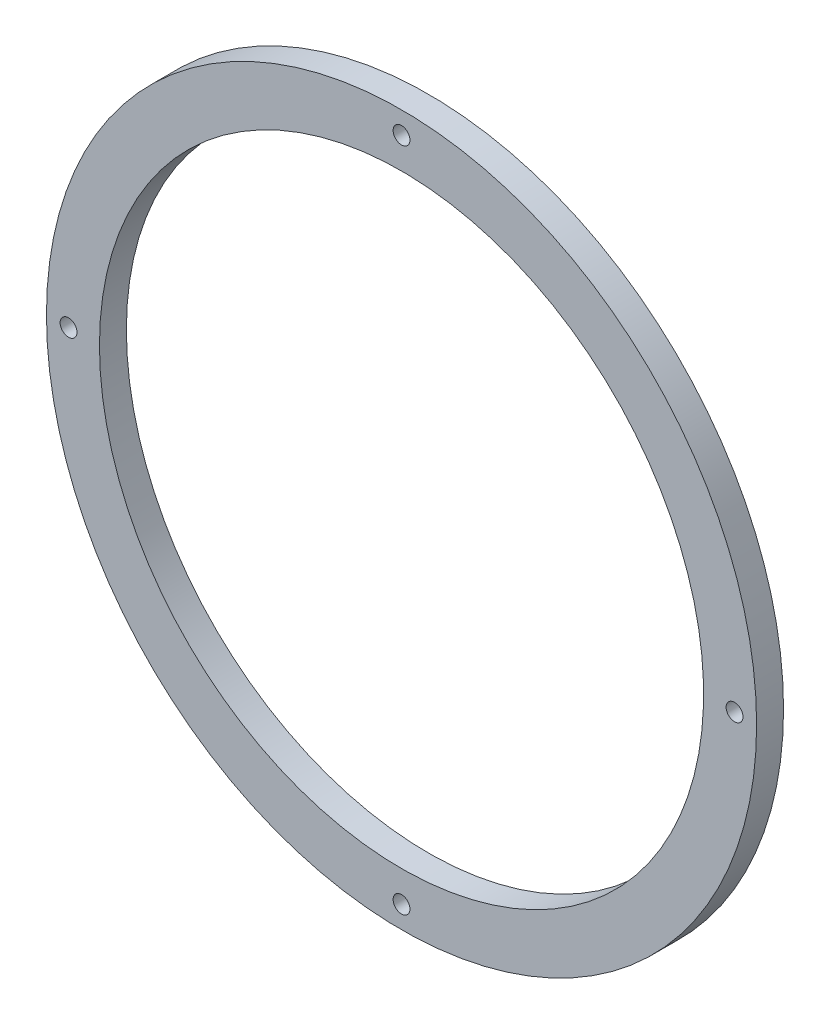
SolidWorks part; units mm, degrees
ref_plane "Front Plane" through (0, 0, 0) normal (0, 0, 1) x (1, 0, 0)
ref_plane "Top Plane" through (0, 0, 0) normal (0, 1, 0) x (1, 0, 0)
ref_plane "Right Plane" through (0, 0, 0) normal (1, 0, 0) x (0, 0, -1)
sketch "Sketch1" plane through (0, 0, 0) normal (0, 0, 1) x (1, 0, 0)
  line L0 (0, 94.25) -> (0, 0) construction
  line L1 (0, 0) -> (-94.25, 0) construction
  circle A0 centre (0, 0) radius 100.5
  circle A1 centre (0, 0) radius 85.5
  circle A2 centre (0, 94.25) radius 2.3812
  circle A3 centre (94.25, 0) radius 2.3813
  circle A4 centre (0, -94.25) radius 2.3812
  circle A5 centre (-94.25, 0) radius 2.3813
  point P16 (0, 0)
  dimension "D1" = 171
  dimension "D4" = 4.7625
  dimension "D3" = 94.25
  dimension "D6" = 94.25
  dimension "D2" = 15
  dimension "D5" = 4
extrude "Boss-Extrude1" add sketch "Sketch1" along normal blind 7.62
